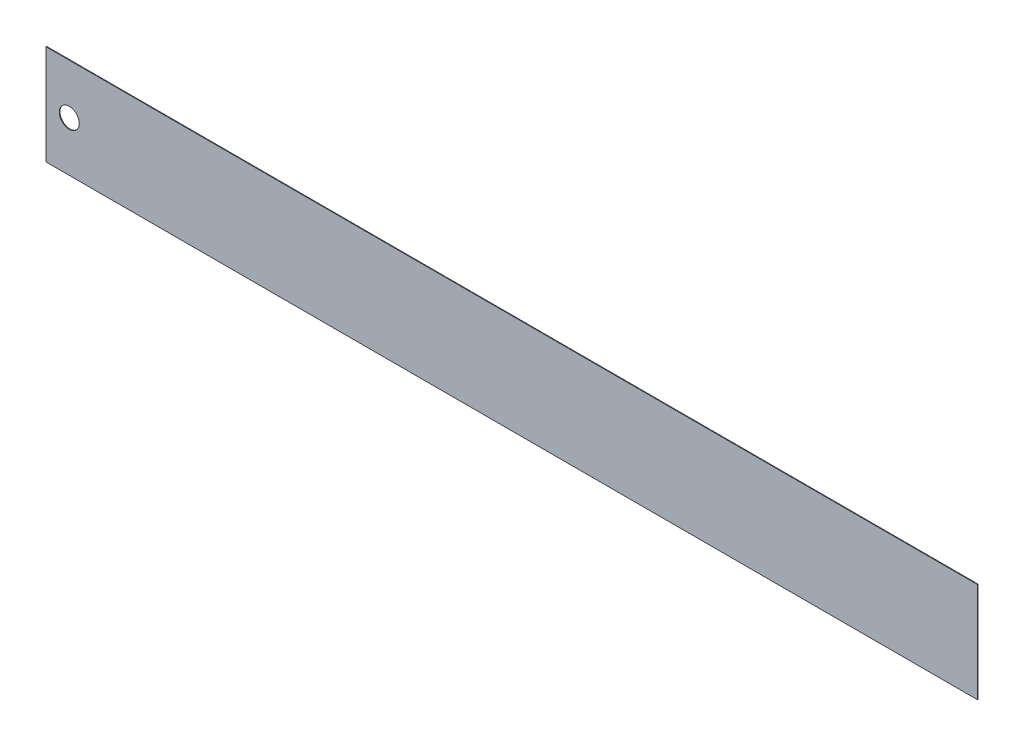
SolidWorks part; units mm, degrees
ref_plane "Front Plane" through (0, 0, 0) normal (0, 0, 1) x (1, 0, 0)
ref_plane "Top Plane" through (0, 0, 0) normal (0, 1, 0) x (1, 0, 0)
ref_plane "Right Plane" through (0, 0, 0) normal (1, 0, 0) x (0, 0, -1)
sketch "Sketch1" plane through (0, 0, 0) normal (0, 0, 1) x (1, 0, 0)
  line L1 (-71.5184, 24.1198) -> (68.4816, 24.1198)
  line L2 (-71.5184, 24.1198) -> (-71.5184, 9.1198)
  line L3 (-71.5184, 9.1198) -> (68.4816, 9.1198)
  line L4 (68.4816, 24.1198) -> (68.4816, 9.1198)
  circle A0 centre (-68.0184, 16.6198) radius 1.5
extrude "Boss-Extrude2" add sketch "Sketch1" along normal blind 0.1
